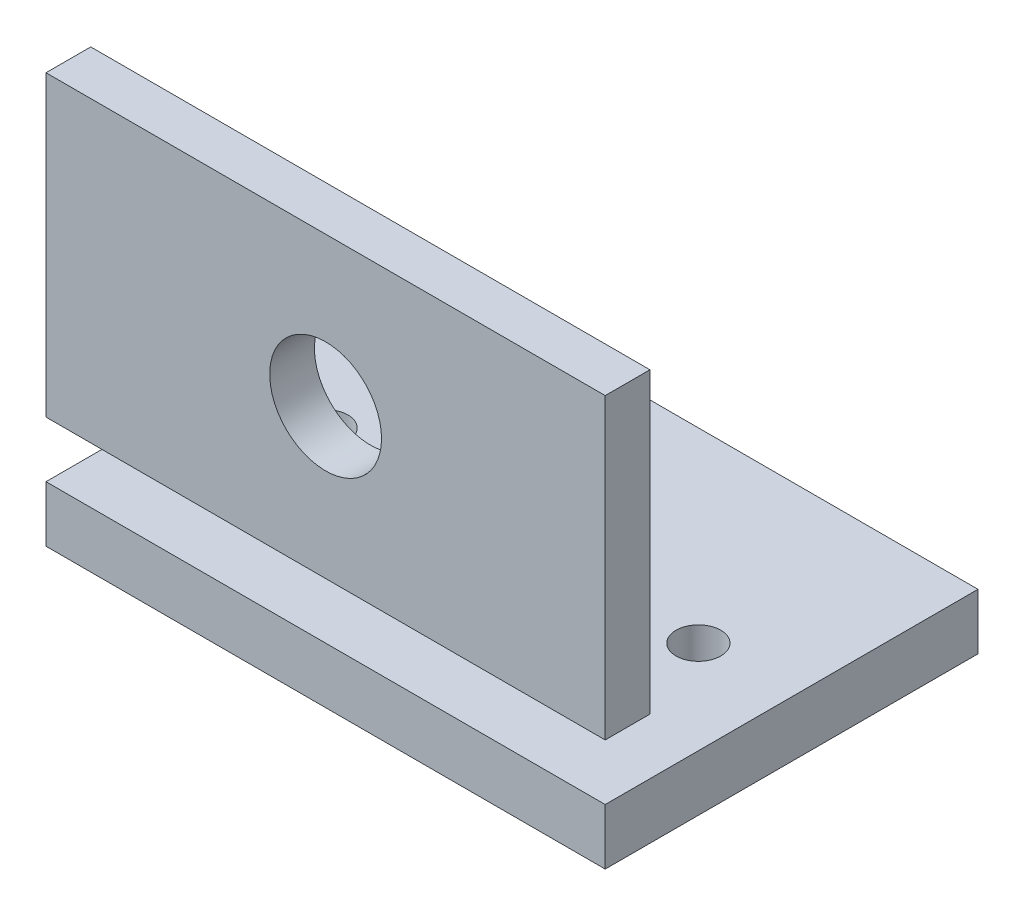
SolidWorks part; units mm, degrees
ref_plane "前视基准面" through (0, 0, 0) normal (0, 0, 1) x (1, 0, 0)
ref_plane "上视基准面" through (0, 0, 0) normal (0, 1, 0) x (1, 0, 0)
ref_plane "右视基准面" through (0, 0, 0) normal (1, 0, 0) x (0, 0, -1)
other "Configuration Table"
sketch "BaseSketch" plane through (0, 0, 0) normal (0, 1, 0) x (1, 0, 0)
  line L1 (0, 0) -> (150, 0)
  line L2 (0, 0) -> (0, 100)
  line L3 (0, 100) -> (150, 100)
  line L4 (150, 0) -> (150, 100)
  dimension "D1" = 150
  dimension "D2" = 100
extrude "BaseBoss" add sketch "BaseSketch" against normal blind 15
sketch "MountHolesSketch" plane through (0, 0, 0) normal (0, 1, 0) x (1, 0, 0)
  line L0 (25, 50) -> (125, 50) construction
  circle A0 centre (25, 50) radius 6
  circle A1 centre (125, 50) radius 6
  dimension "D2" = 12
  dimension "D3" = 12
  dimension "D1" = 100
extrude "MountHolesCut" cut sketch "MountHolesSketch" against normal blind 15
sketch "UprightSketch" plane through (0, 0, 0) normal (0, 0, 1) x (1, 0, 0)
  line L1 (0, 15) -> (150, 15)
  line L2 (0, 15) -> (0, 95)
  line L3 (0, 95) -> (150, 95)
  line L4 (150, 15) -> (150, 95)
  dimension "D1" = 80
extrude "UprightBoss" add sketch "UprightSketch" against normal blind 12
sketch "ShaftBoreSketch" plane through (0, 0, 0) normal (0, 0, 1) x (1, 0, 0)
  circle A0 centre (75, 55) radius 15
  dimension "D1" = 30
extrude "ShaftBoreCut" cut sketch "ShaftBoreSketch" against normal blind 12
